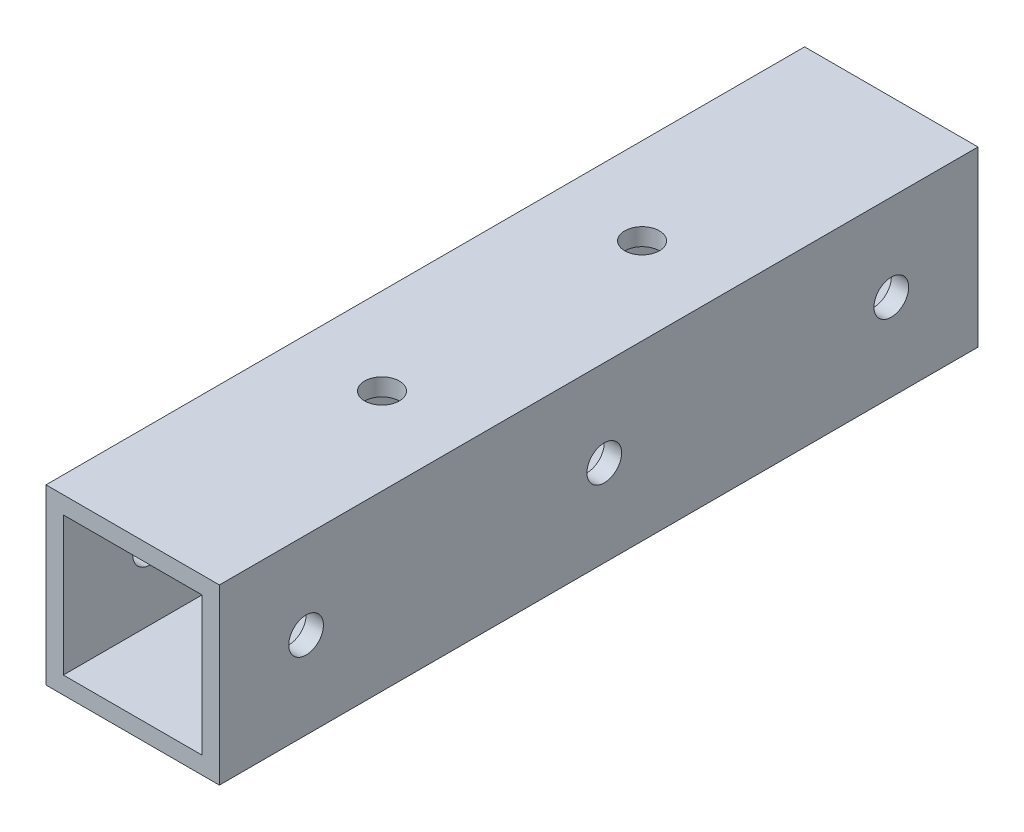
SolidWorks part; units mm, degrees
ref_plane "前视基准面" through (0, 0, 0) normal (0, 0, 1) x (1, 0, 0)
ref_plane "上视基准面" through (0, 0, 0) normal (0, 1, 0) x (1, 0, 0)
ref_plane "右视基准面" through (0, 0, 0) normal (1, 0, 0) x (0, 0, -1)
sketch "草图1" plane through (0, 0, 0) normal (0, 0, 1) x (1, 0, 0)
  line L0 (-8, 8) -> (8, 8)
  line L1 (-10, 10) -> (10, 10)
  line L2 (-10, 10) -> (-10, -10)
  line L3 (-10, -10) -> (10, -10)
  line L4 (10, 10) -> (10, -10)
  line L5 (-10, 10) -> (10, -10) construction
  line L6 (-10, -10) -> (10, 10) construction
  line L7 (8, 8) -> (8, -8)
  line L8 (-8, -8) -> (8, -8)
  line L9 (-8, 8) -> (-8, -8)
  point P0 (0, 0)
  dimension "D1" = 20
  dimension "D2" = 20
  dimension "D3" = 2
extrude "凸台-拉伸1" add sketch "草图1" along normal blind 87.5
hole_wizard "Ø4.0 (4) 直径孔1" positions "草图2" profile "草图3" hole size "Ø4.0" standard "GB"
sketch "草图2" plane through (-10, 0, 0) normal (-1, 0, 0) x (0, 0, 1)
  point P0 (10, 0)
  point P3 (43.1091, 0)
  point P6 (77.5, 0)
sketch "草图3" plane through (-10, 0, 10) normal (0, 1, 0) x (0, 0, 1)
  line L0 (0, 0) -> (0, 20)
  line L1 (0, 20) -> (2, 20)
  line L2 (2, 20) -> (2, 0)
  line L5 (2, 0) -> (0, 0)
  line L11 (0, -6.35) -> (0, 107.95) construction
  dimension "通孔孔直径" = 4
  dimension "通孔孔深度" = 20
hole_wizard "Ø4.0 (4) 直径孔2" positions "草图4" profile "草图5" hole size "Ø4.0" standard "GB"
sketch "草图4" plane through (0, 10, 0) normal (0, 1, 0) x (1, 0, 0)
  line L0 (-10, -87.5) -> (-10, 0) construction
  point P0 (0, -58.75)
  point P2 (0, -28.75)
  point P7 (-10, -43.75)
  dimension "D1" = 30
  dimension "D2" = 15
  dimension "D3" = 10
sketch "草图5" plane through (0, 10, 58.75) normal (1, 0, 0) x (0, 0, 1)
  line L0 (0, 0) -> (0, 20)
  line L1 (0, 20) -> (2, 20)
  line L2 (2, 20) -> (2, 0)
  line L5 (2, 0) -> (0, 0)
  line L11 (0, -6.35) -> (0, 107.95) construction
  dimension "通孔孔直径" = 4
  dimension "通孔孔深度" = 20
